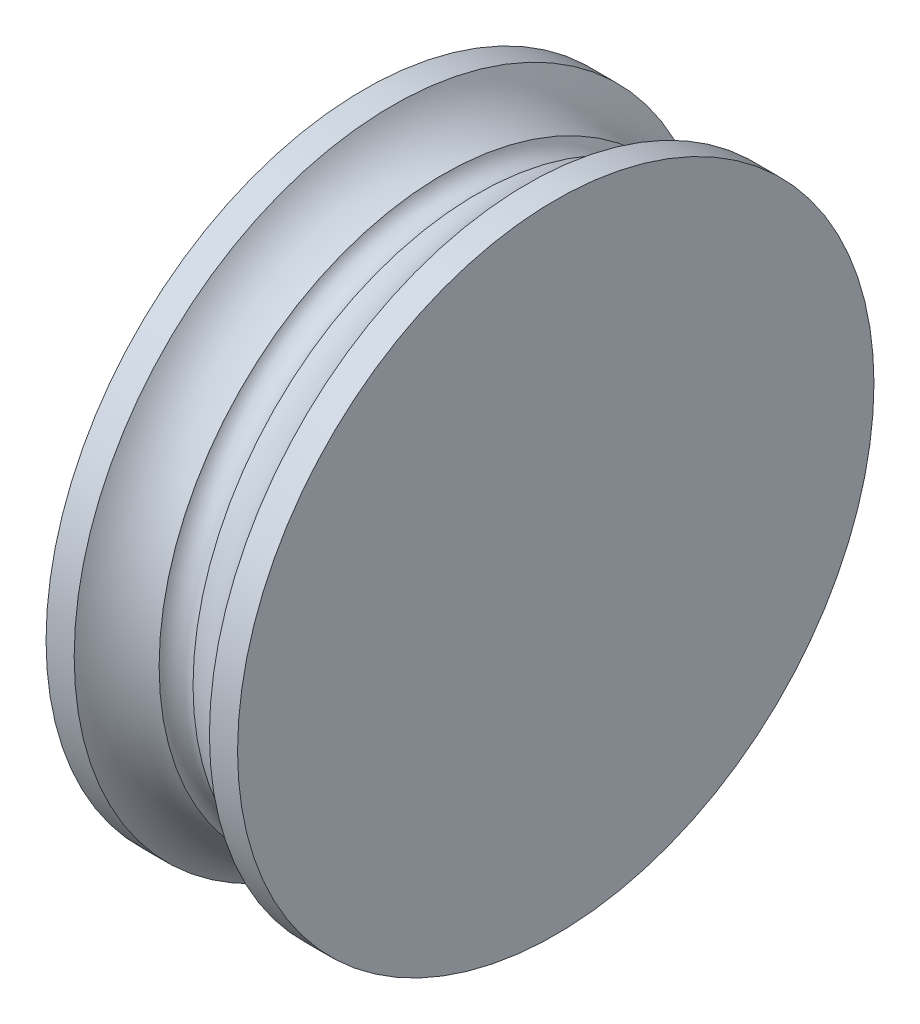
SolidWorks part; units mm, degrees
ref_plane "Front Plane" through (0, 0, 0) normal (0, 0, 1) x (1, 0, 0)
ref_plane "Top Plane" through (0, 0, 0) normal (0, 1, 0) x (1, 0, 0)
ref_plane "Right Plane" through (0, 0, 0) normal (1, 0, 0) x (0, 0, -1)
sketch "Sketch1" plane through (0, 0, 0) normal (0, 0, 1) x (1, 0, 0)
  line L0 (323.1626, 409.8604) -> (402.7318, 409.8604) construction
  line L1 (-8.955, 0) -> (8.955, 0) construction
  line L2 (0, -29.76) -> (0, 29.76) construction
  line L3 (8.955, 0) -> (8.955, 29.76)
  line L4 (8.955, 29.76) -> (6.325, 29.76)
  line L5 (-8.955, 0) -> (-8.955, 29.76)
  line L6 (-8.955, 29.76) -> (-6.325, 29.76)
  line L7 (-8.955, 0) -> (8.955, 0)
  arc A0 (6.325, 29.76) -> (1.585, 26.5556) centre (0.5452, 33.2017) cw
  arc A1 (1.585, 26.5556) -> (-1.585, 26.5556) centre (0, 27.3415) cw
  arc A2 (-6.325, 29.76) -> (-1.585, 26.5556) centre (-0.5452, 33.2017) ccw
  point P6 (0, 0)
  point P10 (0, 0)
  dimension "D5" = 5.8855
  dimension "D1" = 17.91
  dimension "D2" = 59.52
  dimension "D3" = 2.63
  dimension "D4" = 3.17
revolve "Revolve1" add sketch "Sketch1" angle 360 about L7
